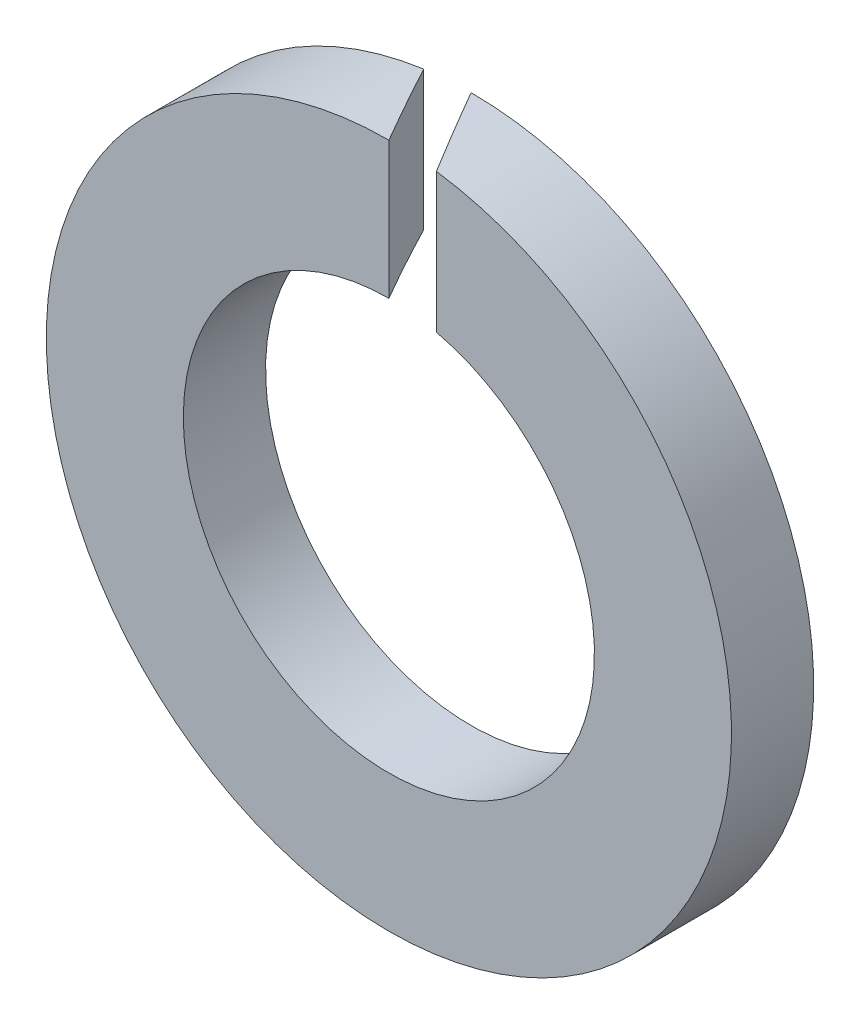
SolidWorks part; units mm, degrees
ref_plane "Front" through (0, 0, 0) normal (0, 0, 1) x (1, 0, 0)
ref_plane "Top" through (0, 0, 0) normal (0, 1, 0) x (1, 0, 0)
ref_plane "Right" through (0, 0, 0) normal (1, 0, 0) x (0, 0, -1)
other "Configuration Table"
sketch "Sketch1" plane through (0, 0, 0) normal (0, 0, 1) x (1, 0, 0)
  circle A0 centre (0, 0) radius 1.5
  circle A1 centre (0, 0) radius 2.5
  dimension "d" = 3
  dimension "b" = 1
extrude "Base-Extrude" add sketch "Sketch1" against normal blind 0.6
sketch "Sketch2" plane through (0, 0, 0) normal (0, 1, 0) x (1, 0, 0)
  line L0 (0, 0.6) -> (0.3464, 0)
  line L1 (0.3464, 0) -> (0, 0)
  line L3 (0, 0) -> (-0.3464, 0.6)
  line L5 (-0.3464, 0.6) -> (0, 0.6)
  line L7 (2.5, 0.6) -> (-2.5, 0.6) construction
  dimension "m" = 0.3
extrude "Cut-Extrude1" cut sketch "Sketch2" along normal through all
